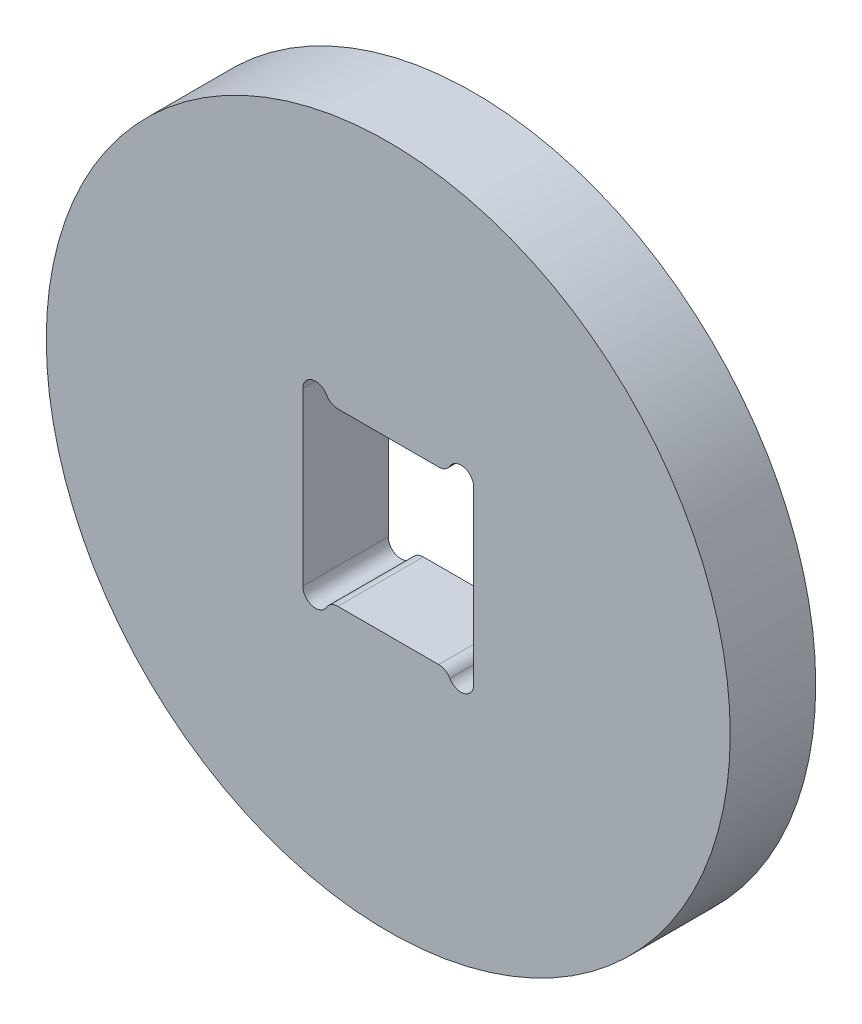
SolidWorks part; units mm, degrees
ref_plane "Plan de face" through (0, 0, 0) normal (0, 0, 1) x (1, 0, 0)
ref_plane "Plan de dessus" through (0, 0, 0) normal (0, 1, 0) x (1, 0, 0)
ref_plane "Plan de droite" through (0, 0, 0) normal (1, 0, 0) x (0, 0, -1)
sketch "Esquisse1" plane through (0, 0, 0) normal (0, 0, 1) x (1, 0, 0)
  line L4 (-5.9019, 10) -> (5.9019, 10)
  line L5 (10, 10) -> (10, -10)
  line L6 (5.9019, -10) -> (-5.9019, -10)
  line L7 (-10, -10) -> (-10, 10)
  arc A0 (-7.201, 10.75) -> (-5.9019, 10) centre (-5.9019, 11.5) ccw
  arc A1 (5.9019, 10) -> (7.201, 10.75) centre (5.9019, 11.5) ccw
  arc A2 (10, 10) -> (7.201, 10.75) centre (8.5, 10) ccw
  arc A3 (7.201, -10.75) -> (10, -10) centre (8.5, -10) ccw
  arc A4 (7.201, -10.75) -> (5.9019, -10) centre (5.9019, -11.5) ccw
  arc A18 (-5.9019, -10) -> (-7.201, -10.75) centre (-5.9019, -11.5) ccw
  arc A19 (-10, -10) -> (-7.201, -10.75) centre (-8.5, -10) ccw
  arc A20 (-7.201, 10.75) -> (-10, 10) centre (-8.5, 10) ccw
  circle A25 centre (0, 0) radius 40
  dimension "D5" = 1.5
  dimension "D6" = 1.5
  dimension "D7" = 1.5
  dimension "D8" = 1.5
  dimension "D9" = 1.5
  dimension "D10" = 1.5
  dimension "D11" = 1.5
  dimension "D12" = 1.5
  dimension "D16" = 80
  dimension "D1" = 20
  dimension "D2" = 20
  dimension "D3" = 10
  dimension "D4" = 10
extrude "Boss.-Extru.1" add sketch "Esquisse1" along normal blind 10
